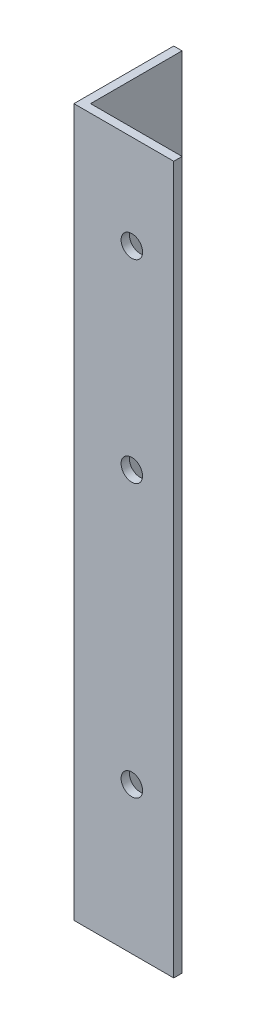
SolidWorks part; units mm, degrees
ref_plane "Front Plane" through (0, 0, 0) normal (0, 0, 1) x (1, 0, 0)
ref_plane "Top Plane" through (0, 0, 0) normal (0, 1, 0) x (1, 0, 0)
ref_plane "Right Plane" through (0, 0, 0) normal (1, 0, 0) x (0, 0, -1)
sketch "Sketch1" plane through (0, 0, 0) normal (0, 1, 0) x (1, 0, 0)
  line L0 (0, 0) -> (19.05, 0)
  line L1 (19.05, 0) -> (19.05, 1.5875)
  line L2 (19.05, 1.5875) -> (1.5875, 1.5875)
  line L3 (1.5875, 1.5875) -> (1.5875, 19.05)
  line L4 (1.5875, 19.05) -> (0, 19.05)
  line L5 (0, 19.05) -> (0, 0)
  dimension "D1" = 19.05
  dimension "D2" = 19.05
  dimension "D3" = 1.5875
  dimension "D4" = 1.5875
extrude "Boss-Extrude1" add sketch "Sketch1" along normal blind 135
sketch "Sketch2" plane through (1.5875, 0, 0) normal (1, 0, 0) x (0, 0, -1)
  line L0 (19.05, 135) -> (19.05, 0) construction
  line L1 (1.5875, 135) -> (19.05, 135) construction
  line L2 (19.05, 135) -> (0, 135) construction
  circle A0 centre (11.05, 117) radius 2.05
  circle A1 centre (11.05, 80) radius 2.05
  circle A2 centre (11.05, 28) radius 2.05
  point P12 (10.3187, 135)
  dimension "D1" = 4.1
  dimension "D2" = 8
  dimension "D3" = 18
  dimension "D4" = 55
  dimension "D5" = 107
extrude "Cut-Extrude1" cut sketch "Sketch2" against normal through all
sketch "Sketch3" plane through (0, 0, -1.5875) normal (0, 0, -1) x (-1, 0, 0)
  line L0 (-19.05, 135) -> (-19.05, 0) construction
  line L2 (-19.05, 135) -> (-1.5875, 135) construction
  circle A0 centre (-11.05, 117) radius 2.05
  circle A1 centre (-11.05, 80) radius 2.05
  circle A2 centre (-11.05, 28) radius 2.05
  dimension "D1" = 8
  dimension "D2" = 4.1
  dimension "D5" = 107
  dimension "D3" = 18
  dimension "D4" = 55
extrude "Cut-Extrude2" cut sketch "Sketch3" against normal through all
sketch "Sketch6" plane through (1.5875, 0, 0) normal (1, 0, 0) x (0, 0, -1)
  circle A0 centre (21.95, 105) radius 9.65
  circle A1 centre (21.95, 20) radius 9.65
  circle A2 centre (21.95, 105) radius 9.65 construction
extrude "Cut-Extrude5" cut sketch "Sketch6" against normal blind 10
